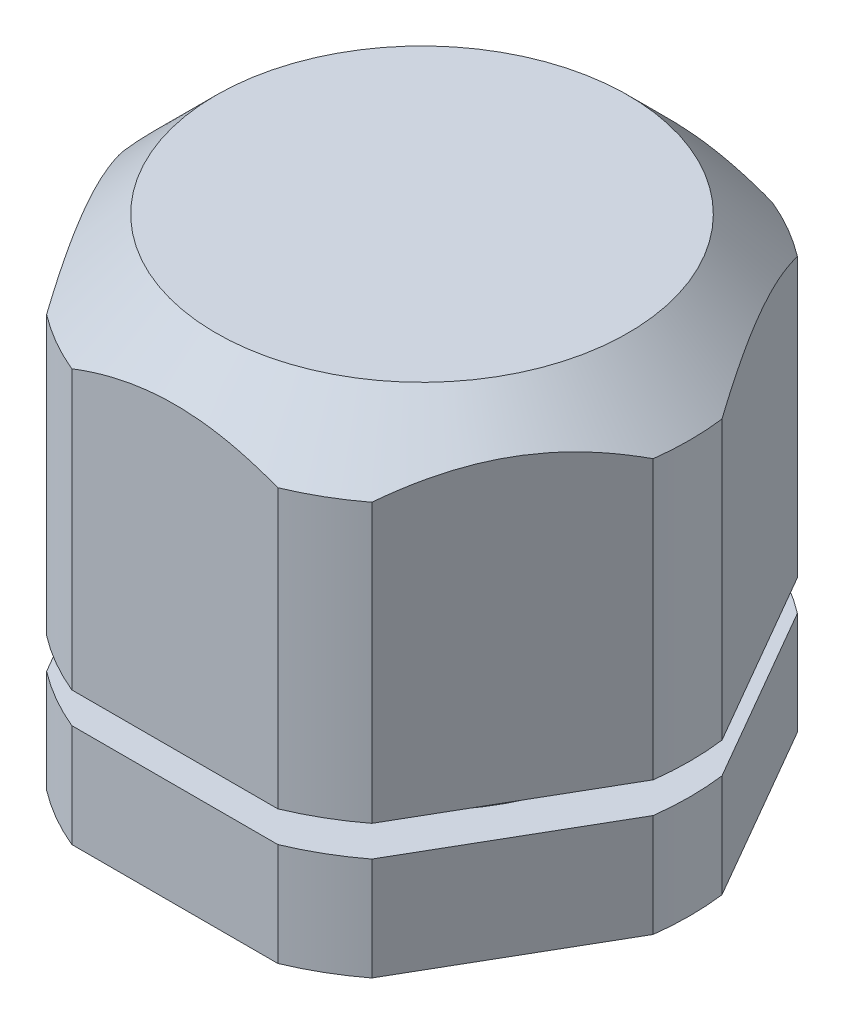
SolidWorks part; units mm, degrees
ref_plane "Plan1" through (0, 0, 0) normal (0, 0, 1) x (1, 0, 0)
ref_plane "Plan2" through (0, 0, 0) normal (0, 1, 0) x (1, 0, 0)
ref_plane "Plan3" through (0, 0, 0) normal (1, 0, 0) x (0, 0, -1)
sketch "Esquisse2" plane through (0, 0, 0) normal (0, 1, 0) x (1, 0, 0)
  line L1 (13.8564, 0) -> (6.9282, 12)
  line L2 (6.9282, 12) -> (-6.9282, 12)
  line L3 (-6.9282, 12) -> (-13.8564, 0)
  line L4 (-13.8564, 0) -> (-6.9282, -12)
  line L5 (-6.9282, -12) -> (6.9282, -12)
  line L6 (6.9282, -12) -> (13.8564, 0)
  circle A0 centre (0, 0) radius 12 construction
  dimension "D1" = 24
extrude "Base-Extrusion" add sketch "Esquisse2" along normal blind 23
sketch "Esquisse3" plane through (0, 23, 0) normal (0, 1, 0) x (-1, 0, 0)
  circle A0 centre (0, 0) radius 13
  circle A1 centre (0, 0) radius 13.8564
  dimension "D1" = 26
extrude "Enlèv. mat.-Extru.1" cut sketch "Esquisse3" against normal through all
sketch "Esquisse4" plane through (0, 0, 0) normal (0, 0, 1) x (1, 0, 0)
  line L0 (13, 0) -> (13, 23) construction
  line L1 (10, 6.5) -> (13, 6.5)
  line L2 (10, 6.5) -> (10, 5)
  line L3 (10, 5) -> (13, 5)
  line L4 (13, 6.5) -> (13, 5)
  line L5 (0, 6.2291) -> (0, -0.8315) construction
  line L6 (7.8923, 0) -> (12.8923, 0) construction
  line L7 (10, 23) -> (13, 20)
  line L8 (13, 20) -> (13, 23)
  line L9 (13, 23) -> (10, 23)
  line L10 (7.8923, 23) -> (12.8923, 23) construction
  dimension "D1" = 5
  dimension "D2" = 1.5
  dimension "D3" = 20
  dimension "D4" = 3
revolve "Enlèvement de matière-Révolution1" cut sketch "Esquisse4" angle 360 about L5
sketch "Esquisse5" plane through (0, 23, 0) normal (0, 1, 0) x (-1, 0, 0)
  circle A0 centre (0, 0) radius 5
  dimension "D1" = 10
